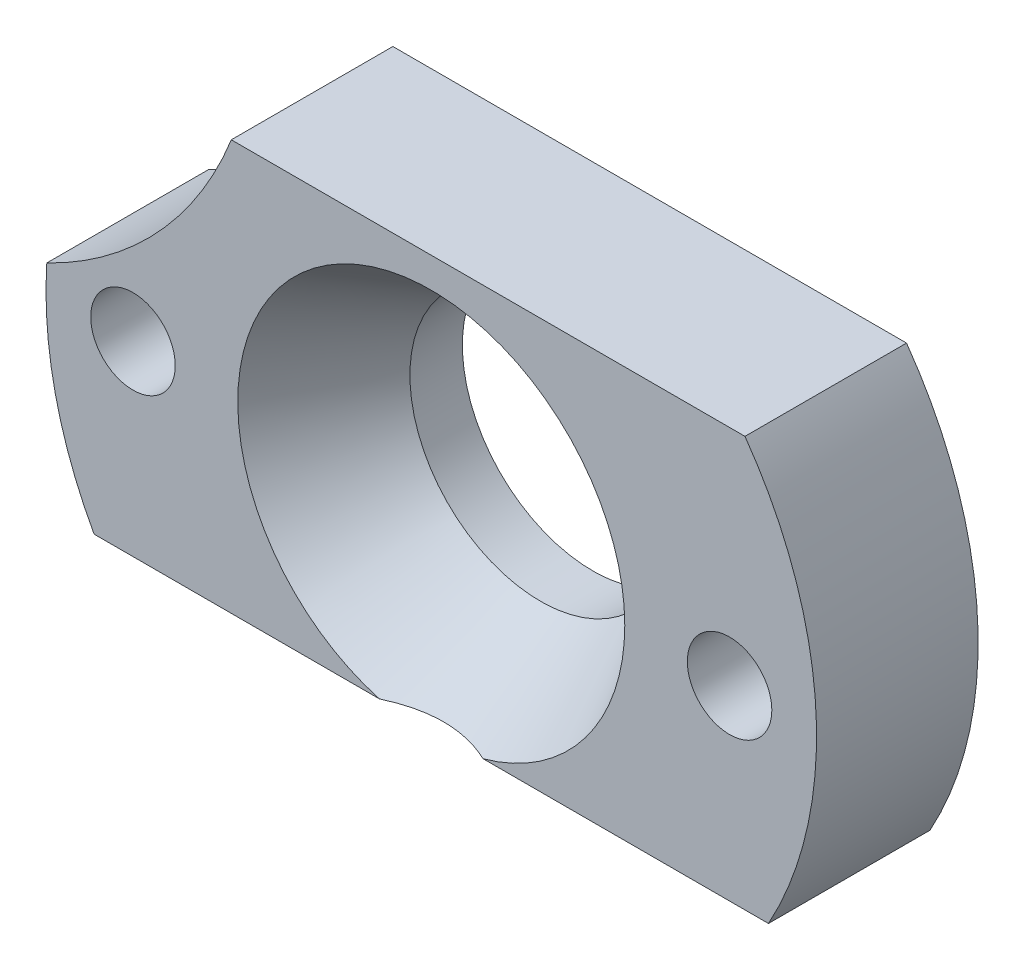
SolidWorks part; units mm, degrees
ref_plane "Vorne" through (0, 0, 0) normal (0, 0, 1) x (1, 0, 0)
ref_plane "Oben" through (0, 0, 0) normal (0, 1, 0) x (1, 0, 0)
ref_plane "Rechts" through (0, 0, 0) normal (1, 0, 0) x (0, 0, -1)
sketch "Skizze1" plane through (0, 0, 0) normal (0, 0, 1) x (1, 0, 0)
  line L0 (0, -15.6019) -> (0, 36.0403) construction
  line L1 (13.5647, -7.5) -> (-13.5647, -7.5)
  line L2 (12.6194, 9) -> (-12.6194, 9)
  arc A0 (13.5647, -7.5) -> (12.6194, 9) centre (0, 0) ccw
  arc A1 (-13.5647, -7.5) -> (-12.6194, 9) centre (0, 0) cw
  point P10 (0, -7.5)
  point P11 (0, 9)
  dimension "D1" = 15.5
  dimension "D2" = 7.5
  dimension "D3" = 16.5
extrude "Linear austragen1" add sketch "Skizze1" along normal blind 6.5
hole_wizard "Ø3.4 (3.4) Durchmesser Bohrung1" positions "Skizze3" profile "Skizze2" hole size "Ø3.4" standard "ISO"
sketch "Skizze3" plane through (0, 0, 6.5) normal (0, 0, 1) x (1, 0, 0)
  point P1 (-12, 0)
  point P3 (12, 0)
  dimension "D1" = 12
  dimension "D2" = 12
sketch "Skizze2" plane through (-12, 0, 6.5) normal (1, 0, 0) x (0, -1, 0)
  line L0 (0, 0) -> (0, 6.5)
  line L1 (0, 6.5) -> (1.7, 6.5)
  line L2 (1.7, 6.5) -> (1.7, 0)
  line L5 (1.7, 0) -> (0, 0)
  line L11 (0, -6.35) -> (0, 107.95) construction
  dimension "Bohrerdurchmesser" = 3.4
  dimension "Bohrungstiefe" = 6.5
hole_wizard "Formsenkung für M1.6 Linsensenkschraube mit Schlitz1" positions "Skizze5" profile "Skizze4" countersink size "M1.6" standard "ISO"
sketch "Skizze5" plane through (0, 0, 6.5) normal (0, 0, 1) x (1, 0, 0)
  point P0 (0, 0)
sketch "Skizze4" plane through (0, 0, 6.5) normal (1, 0, 0) x (0, -1, 0)
  line L0 (0, 0) -> (0, 6.5)
  line L1 (0, 6.5) -> (5.25, 6.5)
  line L2 (5.25, 6.5) -> (5.25, 4.39)
  line L3 (5.25, 4.39) -> (7.7846, 0)
  line L5 (7.7846, 0) -> (0, 0)
  line L6 (-5.25, 4.39) -> (-7.7846, 0) construction
  line L11 (0, -6.35) -> (0, 107.95) construction
  dimension "Bohrerdurchmesser" = 10.5
  dimension "Bohrungstiefe" = 6.5
  dimension "Senkwinkel (Oben)" = 60
sketch "Skizze7" plane through (0, 0, 0) normal (0, 0, -1) x (-1, 0, 0)
  line L0 (0, 0) -> (0, 29.5733) construction
  circle A1 centre (22, 14.5) radius 15
  dimension "D1" = 22
  dimension "D3" = 30
  dimension "D2" = 14.5
extrude "Schnitt-Linear austragen1" cut sketch "Skizze7" against normal through all
